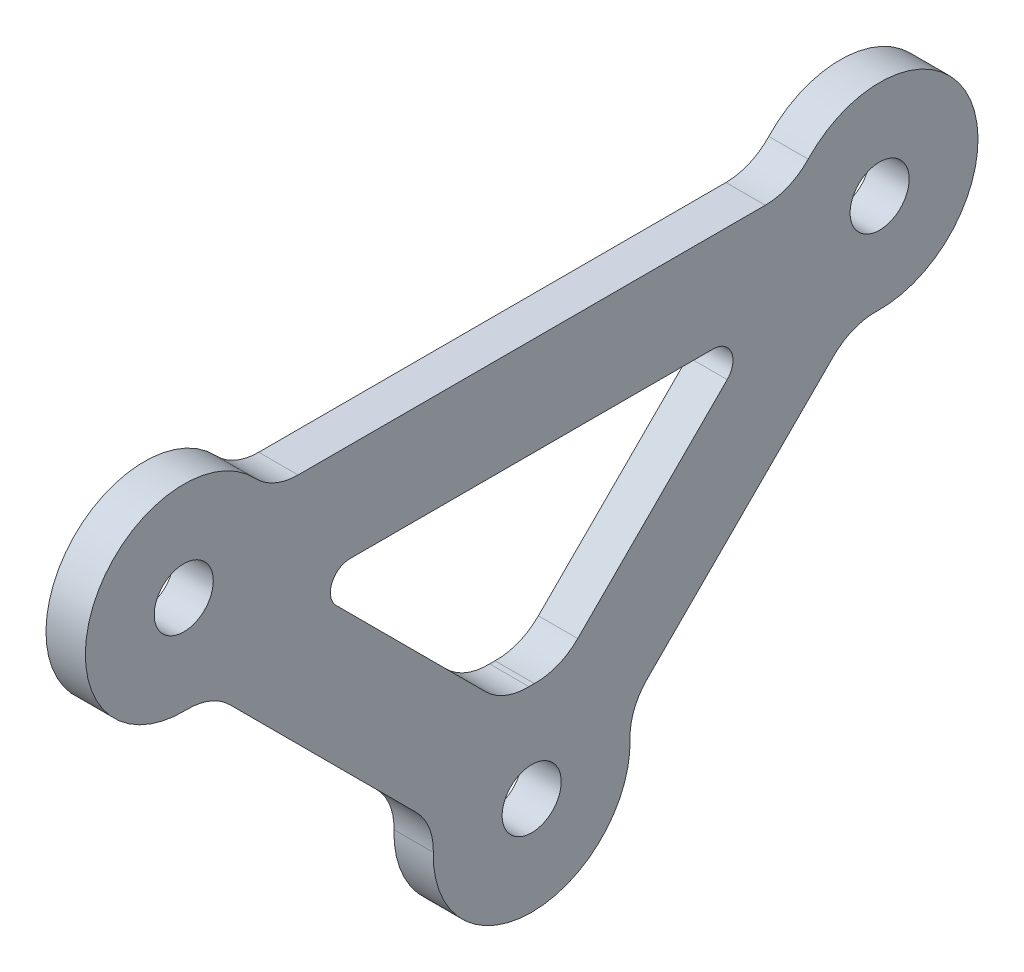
SolidWorks part; units mm, degrees
ref_plane "Front Plane" through (0, 0, 0) normal (0, 0, 1) x (1, 0, 0)
ref_plane "Top Plane" through (0, 0, 0) normal (0, 1, 0) x (1, 0, 0)
ref_plane "Right Plane" through (0, 0, 0) normal (1, 0, 0) x (0, 0, -1)
sketch "Sketch1" plane through (0, 0, 0) normal (1, 0, 0) x (0, 0, -1)
  line L0 (0, 0) -> (17.6777, 17.6777) construction
  line L1 (17.6777, 17.6777) -> (-17.6777, 17.6777) construction
  line L2 (-17.6777, 17.6777) -> (0, 0) construction
  line L3 (0, 0) -> (0, 17.6777) construction
  line L4 (0, 0) -> (17.6777, 0) construction
  line L5 (0, -3.5355) -> (23.7132, 20.1777)
  line L6 (23.7132, 20.1777) -> (-23.7132, 20.1777)
  line L7 (-23.7132, 20.1777) -> (0, -3.5355)
  line L8 (0, 3.5355) -> (11.6421, 15.1777)
  line L9 (11.6421, 15.1777) -> (-11.6421, 15.1777)
  line L10 (-11.6421, 15.1777) -> (0, 3.5355)
  circle A0 centre (-17.6777, 17.6777) radius 1.5
  circle A1 centre (17.6777, 17.6777) radius 1.5
  circle A2 centre (0, 0) radius 1.5
  dimension "D5" = 3
  dimension "D1" = 45
  dimension "D2" = 25
  dimension "D3" = 2.5
  dimension "D4" = 2.5
extrude "Boss-Extrude1" add sketch "Sketch1" along normal blind 2
fillet "Fillet3" radius 2.5 3 edges at (1, -3.5355, 0) (1, 20.1777, -23.7132) (1, 20.1777, 23.7132)
sketch "Sketch6" plane through (2, 0, 0) normal (1, 0, 0) x (0, 0, -1)
  circle A0 centre (-17.6777, 17.6777) radius 5
  circle A1 centre (17.6777, 17.6777) radius 5
  circle A2 centre (0, 0) radius 5
  circle A3 centre (0, 0) radius 1.5 construction
  circle A4 centre (17.6777, 17.6777) radius 1.5 construction
  circle A5 centre (-17.6777, 17.6777) radius 1.5 construction
  circle A6 centre (0, 0) radius 1.5
  circle A7 centre (17.6777, 17.6777) radius 1.5
  circle A8 centre (-17.6777, 17.6777) radius 1.5
  dimension "D1" = 10
extrude "Boss-Extrude2" add sketch "Sketch6" against normal up to surface (2 mm away)
fillet "Fillet4" radius 3 8 edges at (1, 4.8296, 1.2941) (1, 4.8296, -1.2941) (1, 1.2941, 4.8296) (1, 1.2941, -4.8296) (1, 12.848, -16.3836) (1, 20.1777, -13.3475) (1, 20.1777, 13.3475) (1, 12.848, 16.3836)
fillet "Fillet5" radius 1 2 edges at (1, 15.1777, 11.6421) (1, 15.1777, -11.6421)
